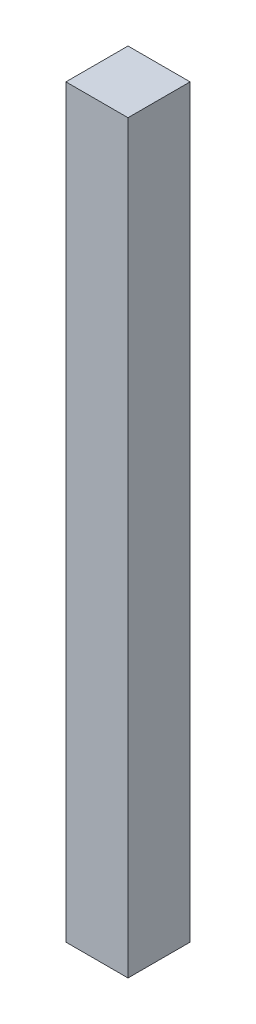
SolidWorks part; units mm, degrees
ref_plane "Front Plane" through (0, 0, 0) normal (0, 0, 1) x (1, 0, 0)
ref_plane "Top Plane" through (0, 0, 0) normal (0, 1, 0) x (1, 0, 0)
ref_plane "Right Plane" through (0, 0, 0) normal (1, 0, 0) x (0, 0, -1)
sketch "Sketch1" plane through (0, 0, 0) normal (0, 1, 0) x (1, 0, 0)
  line L1 (0, 0) -> (25.4, 0)
  line L2 (0, 0) -> (0, 25.4)
  line L3 (0, 25.4) -> (25.4, 25.4)
  line L4 (25.4, 0) -> (25.4, 25.4)
  dimension "D1" = 25.4
  dimension "D2" = 25.4
extrude "Boss-Extrude1" add sketch "Sketch1" along normal blind 304.8
